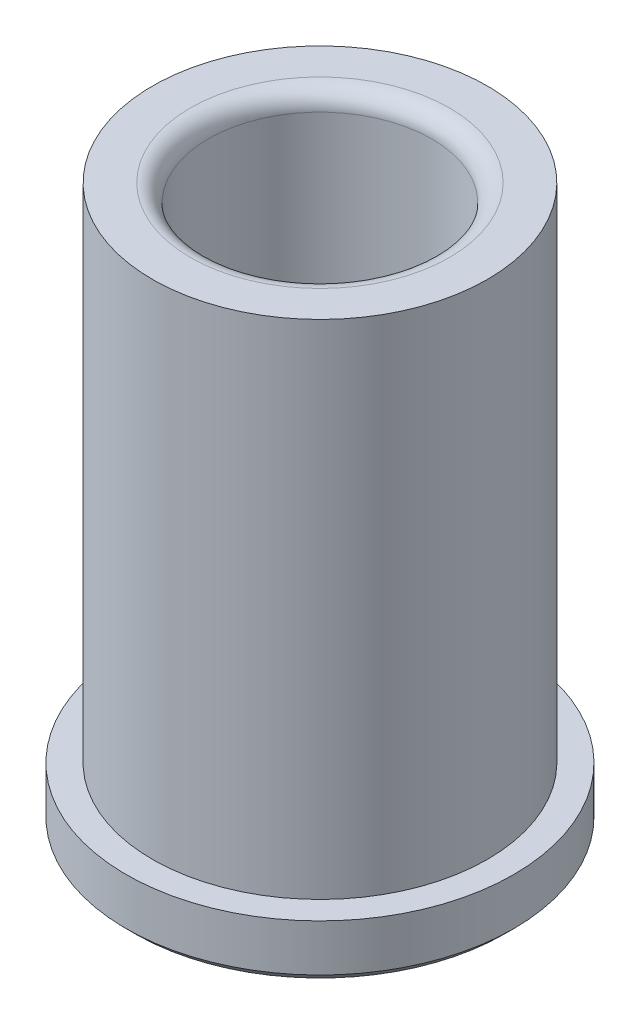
SolidWorks part; units mm, degrees
ref_plane "Front Plane" through (0, 0, 0) normal (0, 0, 1) x (1, 0, 0)
ref_plane "Top Plane" through (0, 0, 0) normal (0, 1, 0) x (1, 0, 0)
ref_plane "Right Plane" through (0, 0, 0) normal (1, 0, 0) x (0, 0, -1)
sketch "Sketch1" plane through (0, 0, 0) normal (0, 0, 1) x (1, 0, 0)
  line L0 (-15.7734, 0) -> (-16.5354, 0.762)
  line L1 (0, -1000) -> (0, 49000) construction
  line L2 (-9.5314, 47.625) -> (-9.5313, 0.762)
  line L3 (-10.2933, 0) -> (-15.7734, 0)
  line L4 (-16.5354, 0.762) -> (-16.5354, 4.7625)
  line L5 (-16.5354, 4.7625) -> (-14.2938, 4.7625)
  line L6 (-14.2939, 47.625) -> (-14.2938, 4.7625)
  line L7 (-14.2939, 47.625) -> (-9.5314, 47.625)
  line L8 (-10.2933, 0) -> (-9.5313, 0.762)
  dimension "OD" = 28.5877
  dimension "ID" = 19.0627
  dimension "H" = 33.0708
  dimension "D2" = 45
  dimension "OVERALL LENGTH" = 47.625
  dimension "D4" = 0.762
  dimension "D5" = 135
  dimension "T" = 4.7625
revolve "Revolve1" add sketch "Sketch1" angle 360 about L1
fillet "Fillet1" radius 1.524 1 edges at (9.5313, 47.625, 0)
